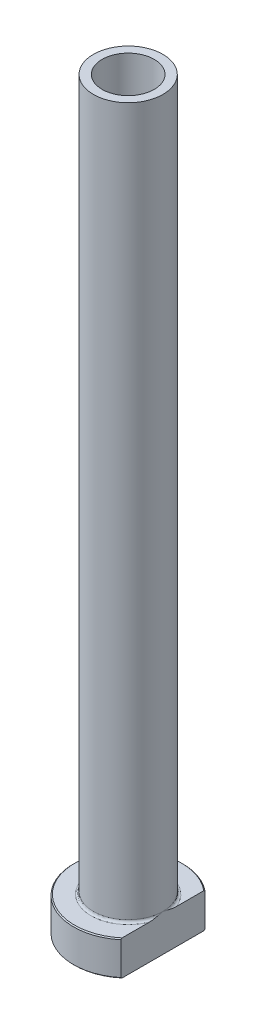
SolidWorks part; units mm, degrees
ref_plane "Front Plane" through (0, 0, 0) normal (0, 0, 1) x (1, 0, 0)
ref_plane "Top Plane" through (0, 0, 0) normal (0, 1, 0) x (1, 0, 0)
ref_plane "Right Plane" through (0, 0, 0) normal (1, 0, 0) x (0, 0, -1)
sketch "Sketch1" plane through (0, 0, 0) normal (0, 0, 1) x (1, 0, 0)
  line L0 (-5.25, 150) -> (-7, 150)
  line L1 (-7, 150) -> (-7, 7)
  line L2 (-7, 7) -> (-11, 7)
  line L3 (-11, 7) -> (-11, 0)
  line L4 (9.9, 0) -> (-9.9, 0) construction
  line L5 (-11, 0) -> (-5.5, 0)
  line L6 (-5.25, 95) -> (-5.25, 150)
  line L7 (0, 92.1877) -> (0, -15.5353) construction
  line L8 (0, -12.1) -> (0, 12.1) construction
  line L9 (-5.25, 95) -> (-5.5, 83)
  line L10 (-5.5, 83) -> (-5.5, 0)
  dimension "D1" = 0.25
  dimension "ID" = 10.5
  dimension "OD" = 14
  dimension "L" = 150
  dimension "H" = 22
  dimension "T" = 7
  dimension "N" = 55
  dimension "D2" = 12
  dimension "L-N" = 95
revolve "Revolve1" add sketch "Sketch1" angle 360 about L7
fillet "Fillet1" radius 0.5 1 edges at (0, 7, 7)
chamfer "Chamfer1" distance 0.2 angle 45 2 edges at (0, 7, 11) (0, 0, 11)
sketch "Sketch2" plane through (0, 0, 0) normal (0, -1, 0) x (1, 0, 0)
  line L0 (7, 8.4853) -> (7, -8.4853)
  circle A0 centre (0, 0) radius 11 construction
  arc A1 (7, 8.4853) -> (7, -8.4853) centre (0, 0) cw
  circle A2 centre (0, 0) radius 7 construction
extrude "Cut-Extrude1" cut sketch "Sketch2" against normal through all
chamfer "Chamfer2" distance 0.5 angle 45 1 edges at (0, 0, 5.5)
